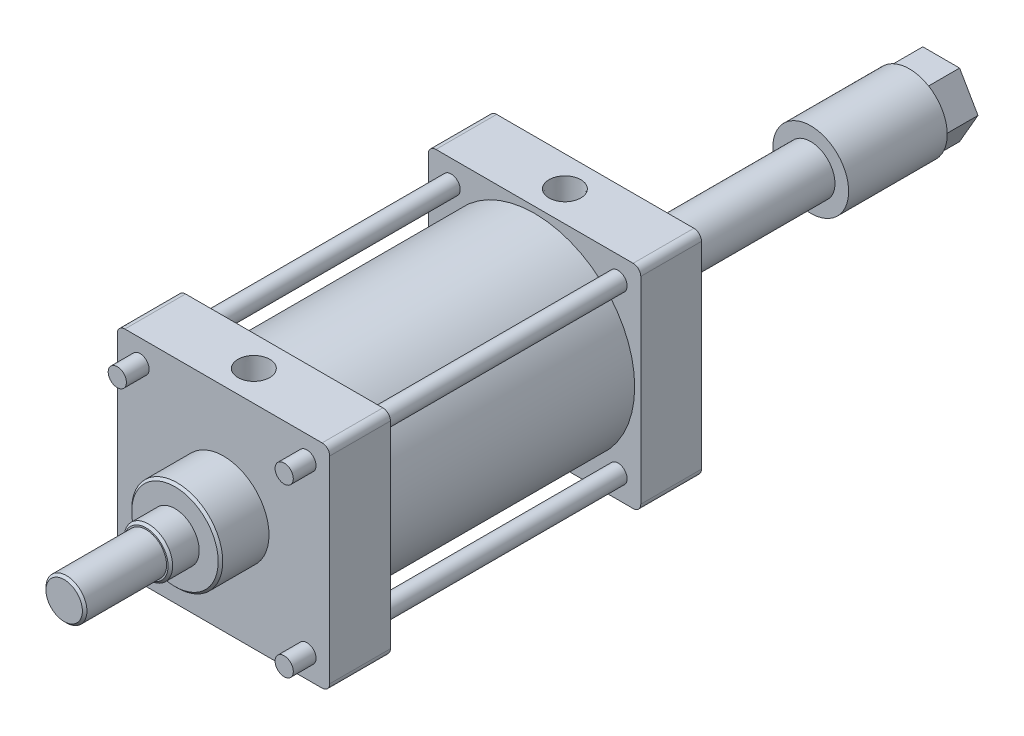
SolidWorks part; units mm, degrees
ref_plane "前视基准面" through (0, 0, 0) normal (0, 0, 1) x (1, 0, 0)
ref_plane "上视基准面" through (0, 0, 0) normal (0, 1, 0) x (1, 0, 0)
ref_plane "右视基准面" through (0, 0, 0) normal (1, 0, 0) x (0, 0, -1)
sketch "草图1" plane through (0, 0, 0) normal (0, 0, 1) x (1, 0, 0)
  line L0 (0, 0) -> (55, 0) construction
  line L1 (65, 70) -> (-65, 70)
  line L2 (70, 65) -> (70, -65)
  line L3 (65, -70) -> (-65, -70)
  line L4 (-70, 65) -> (-70, -65)
  line L5 (70, 70) -> (-70, -70) construction
  line L6 (70, -70) -> (-70, 70) construction
  line L7 (55, 0) -> (55, -55) construction
  arc A0 (-70, -65) -> (-65, -70) centre (-65, -65) ccw
  arc A1 (70, -65) -> (65, -70) centre (65, -65) cw
  arc A2 (65, 70) -> (70, 65) centre (65, 65) cw
  arc A3 (-70, 65) -> (-65, 70) centre (-65, 65) cw
  circle A4 centre (55, -55) radius 6
  circle A5 centre (-55, -55) radius 6
  circle A6 centre (-55, 55) radius 6
  circle A7 centre (55, 55) radius 6
  point P0 (0, 0)
  point P31 (0, 0)
  dimension "D3" = 5
  dimension "D4" = 4
  dimension "D1" = 140
  dimension "D2" = 140
extrude "凸台-拉伸1" add sketch "草图1" along normal blind 40
sketch "草图2" plane through (0, 0, 0) normal (0, 0, -1) x (-1, 0, 0)
  circle A0 centre (0, 0) radius 66
extrude "凸台-拉伸2" add sketch "草图2" along normal blind 165
sketch "草图3" plane through (0, 0, -165) normal (0, 0, -1) x (-1, 0, 0)
  line L4 (70, -65) -> (70, 65)
  line L5 (65, 70) -> (-65, 70)
  line L6 (-70, 65) -> (-70, -65)
  line L7 (-65, -70) -> (65, -70)
  line L8 (70, -65) -> (70, 65)
  line L9 (65, 70) -> (-65, 70)
  line L10 (-70, 65) -> (-70, -65)
  line L11 (-65, -70) -> (65, -70)
  circle A0 centre (55, -55) radius 6 construction
  circle A1 centre (-55, -55) radius 6 construction
  circle A2 centre (55, 55) radius 6 construction
  circle A3 centre (-55, 55) radius 6 construction
  arc A4 (65, -70) -> (70, -65) centre (65, -65) ccw
  arc A5 (70, 65) -> (65, 70) centre (65, 65) ccw
  arc A6 (-65, 70) -> (-70, 65) centre (-65, 65) ccw
  arc A7 (-70, -65) -> (-65, -70) centre (-65, -65) ccw
  arc A8 (65, -70) -> (70, -65) centre (65, -65) ccw
  arc A9 (70, 65) -> (65, 70) centre (65, 65) ccw
  arc A10 (-65, 70) -> (-70, 65) centre (-65, 65) ccw
  arc A11 (-70, -65) -> (-65, -70) centre (-65, -65) ccw
  circle A12 centre (55, -55) radius 6
  circle A13 centre (-55, -55) radius 6
  circle A14 centre (55, 55) radius 6
  circle A15 centre (-55, 55) radius 6
  dimension "D1" = 0
extrude "凸台-拉伸3" add sketch "草图3" along normal blind 40
sketch "草图4" plane through (0, 0, 40) normal (0, 0, 1) x (1, 0, 0)
  circle A0 centre (0, 0) radius 30
extrude "凸台-拉伸4" add sketch "草图4" along normal blind 32
sketch "草图5" plane through (0, 0, -205) normal (0, 0, -1) x (-1, 0, 0)
  circle A0 centre (0, 0) radius 30
extrude "凸台-拉伸5" add sketch "草图5" along normal blind 32
sketch "草图6" plane through (0, 0, 72) normal (0, 0, 1) x (1, 0, 0)
  circle A0 centre (0, 0) radius 16
extrude "凸台-拉伸6" add sketch "草图6" along normal blind 19
sketch "草图7" plane through (0, 0, 91) normal (0, 0, 1) x (1, 0, 0)
  circle A0 centre (0, 0) radius 13.5
extrude "凸台-拉伸7" add sketch "草图7" along normal blind 54
chamfer "倒角1" distance 1.5 angle 45 3 edges at (13.5, 0, 145) (16, 0, 91) (30, 0, 72)
chamfer "倒角2" distance 1.5 angle 45 1 edges at (-30, 0, -237)
sketch "草图8" plane through (0, 0, -237) normal (0, 0, -1) x (-1, 0, 0)
  circle A0 centre (0, 0) radius 25
extrude "凸台-拉伸8" add sketch "草图8" along normal blind 10
sketch "草图9" plane through (0, 0, -247) normal (0, 0, -1) x (-1, 0, 0)
  circle A0 centre (0, 0) radius 16
extrude "凸台-拉伸9" add sketch "草图9" along normal blind 100
sketch "草图10" plane through (0, 0, -347) normal (0, 0, -1) x (-1, 0, 0)
  circle A0 centre (0, 0) radius 25
extrude "凸台-拉伸10" add sketch "草图10" along normal blind 65
sketch "草图11" plane through (0, 0, -412) normal (0, 0, -1) x (-1, 0, 0)
  line L1 (24.2487, 0) -> (12.1244, 21)
  line L2 (12.1244, 21) -> (-12.1244, 21)
  line L3 (-12.1244, 21) -> (-24.2487, 0)
  line L4 (-24.2487, 0) -> (-12.1244, -21)
  line L5 (-12.1244, -21) -> (12.1244, -21)
  line L6 (12.1244, -21) -> (24.2487, 0)
  circle A0 centre (0, 0) radius 21 construction
extrude "凸台-拉伸11" add sketch "草图11" along normal blind 21
hole_wizard "1/2 Rc 螺纹孔1" positions "草图12" profile "草图13" size "1/2" standard "ISO"
sketch "草图12" plane through (0, 70, 0) normal (0, 1, 0) x (1, 0, 0)
  line L0 (65, -40) -> (-65, -40) construction
  line L1 (-65, 165) -> (65, 165) construction
  point P0 (0, -20)
  point P2 (0, 185)
  dimension "D1" = 20
  dimension "D2" = 20
sketch "草图13" plane through (0, 70, 20) normal (1, 0, 0) x (0, 0, 1)
  line L0 (0, 0) -> (0, 29.3275)
  line L1 (8.75, 24.07) -> (0, 29.3275)
  line L2 (-8.75, 24.07) -> (0, 29.3275) construction
  line L3 (8.75, 24.07) -> (8.75, 15)
  line L4 (8.75, 15) -> (10.0093, 15)
  line L5 (10.0093, 15) -> (10.4775, 0)
  line L6 (-10.0093, 15) -> (-10.4775, 0) construction
  line L7 (10.4775, 0) -> (0, 0)
  line L8 (0, -6.35) -> (0, 107.95) construction
  line L11 (-8.75, 15) -> (-10.0093, 15) construction
  dimension "螺纹孔钻头直径" = 17.5
  dimension "螺纹孔钻头深度" = 24.07
  dimension "螺纹直径" = 20.955
  dimension "螺纹角度" = 3.576
  dimension "螺纹深度" = 15
  dimension "导头角度" = 118
sketch "草图14" plane through (0, 0, 40) normal (0, 0, 1) x (1, 0, 0)
  circle A0 centre (55, 55) radius 6 construction
  circle A1 centre (55, -55) radius 6 construction
  circle A2 centre (-55, 55) radius 6 construction
  circle A3 centre (-55, -55) radius 6 construction
  circle A4 centre (55, 55) radius 6
  circle A5 centre (55, -55) radius 6
  circle A6 centre (-55, 55) radius 6
  circle A7 centre (-55, -55) radius 6
extrude "凸台-拉伸12" add sketch "草图14" along normal blind 15 and the other way up to surface (245 mm away) separate body
